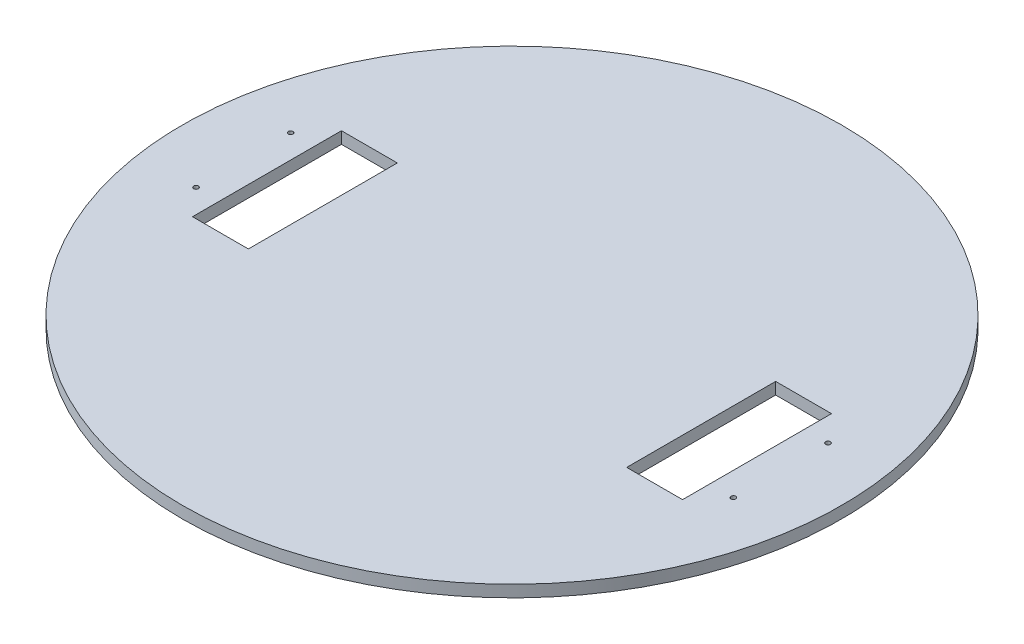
SolidWorks part; units mm, degrees
ref_plane "Front Plane" through (0, 0, 0) normal (0, 0, 1) x (1, 0, 0)
ref_plane "Top Plane" through (0, 0, 0) normal (0, 1, 0) x (1, 0, 0)
ref_plane "Right Plane" through (0, 0, 0) normal (1, 0, 0) x (0, 0, -1)
sketch "Sketch1" plane through (0, 0, 0) normal (0, 1, 0) x (1, 0, 0)
  line L1 (-131.6, 40) -> (-101.6, 40)
  line L2 (-131.6, 40) -> (-131.6, -40)
  line L3 (-131.6, -40) -> (-101.6, -40)
  line L4 (-101.6, 40) -> (-101.6, -40)
  line L13 (101.6, 40) -> (131.6, 40)
  line L14 (101.6, 40) -> (101.6, -40)
  line L15 (101.6, -40) -> (131.6, -40)
  line L16 (131.6, 40) -> (131.6, -40)
  circle A0 centre (0, 0) radius 177
  circle A1 centre (-144.3, 25.4) radius 1.27
  circle A2 centre (-144.3, -25.4) radius 1.27
  circle A3 centre (144.3, 25.4) radius 1.27
  circle A4 centre (144.3, -25.4) radius 1.27
  point P9 (-101.6, 0)
  point P10 (-0.9618, 0)
  point P11 (-0.9618, 0)
  point P14 (101.6, 0)
  point P23 (144.7919, -27.3)
  point P24 (13.376, 40)
  point P25 (146.4034, 27.3)
  point P26 (-131.6, 0)
  point P27 (131.6, 0)
  dimension "D1" = 354
  dimension "D10" = 2.54
  dimension "D12" = 12.7
  dimension "D13" = 2.54
  dimension "D16" = 12.7
  dimension "D17" = 50.8
  dimension "D2" = 30
  dimension "D3" = 80
  dimension "D4" = 0
  dimension "D5" = 101.6
  dimension "D6" = 30
  dimension "D7" = 80
  dimension "D8" = 0
  dimension "D9" = 101.6
  dimension "D11" = 50.8
  dimension "D14" = 12.7
  dimension "D15" = 25.4
  dimension "D18" = 25.4
  dimension "D19" = 12.7
extrude "Boss-Extrude1" add sketch "Sketch1" along normal blind 6.35
